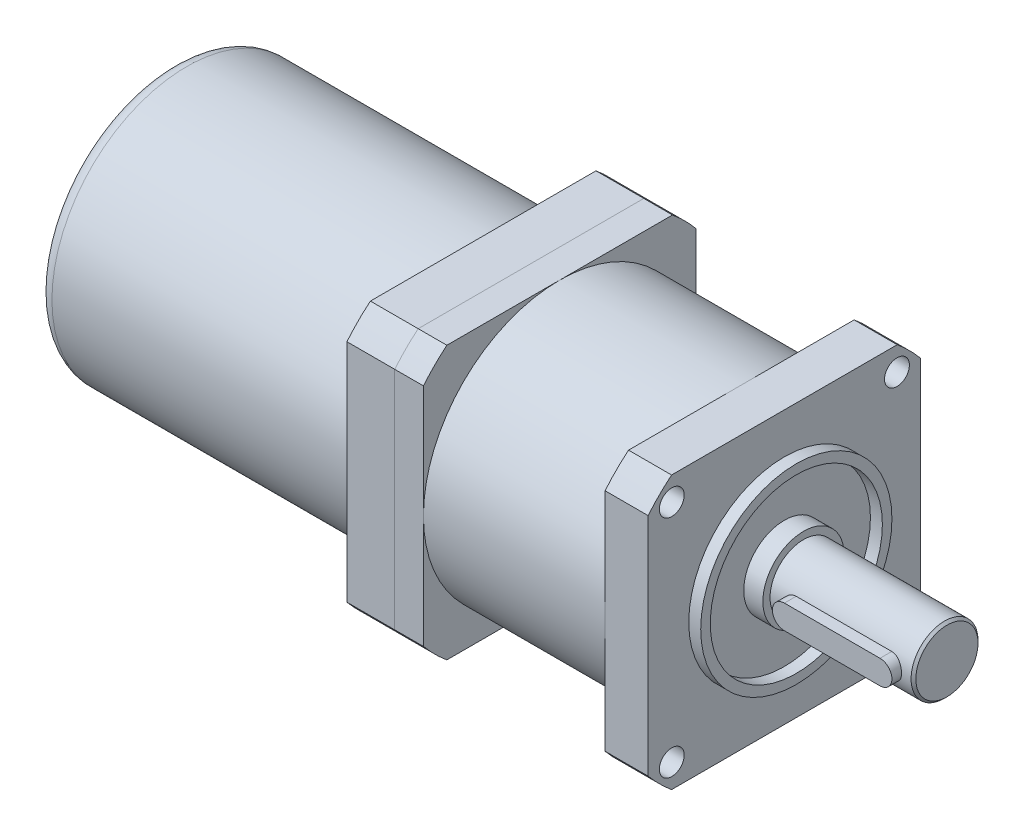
SolidWorks part; units mm, degrees
ref_plane "前视基准面" through (0, 0, 0) normal (0, 0, 1) x (1, 0, 0)
ref_plane "上视基准面" through (0, 0, 0) normal (0, 1, 0) x (1, 0, 0)
ref_plane "右视基准面" through (0, 0, 0) normal (1, 0, 0) x (0, 0, -1)
sketch "草图1" plane through (0, 0, 0) normal (1, 0, 0) x (0, 0, -1)
  line L1 (-23.5956, -28.5) -> (23.5956, -28.5)
  line L2 (-28.5, -23.5956) -> (-28.5, 23.5956)
  line L3 (-23.5956, 28.5) -> (23.5956, 28.5)
  line L4 (28.5, -23.5956) -> (28.5, 23.5956)
  line L5 (-26.163, -26.163) -> (26.163, 26.163) construction
  line L6 (-26.163, 26.163) -> (26.163, -26.163) construction
  arc A0 (-28.5, -23.5956) -> (-23.5956, -28.5) centre (0, 0) ccw
  arc A1 (-23.5956, 28.5) -> (-28.5, 23.5956) centre (0, 0) ccw
  arc A2 (28.5, 23.5956) -> (23.5956, 28.5) centre (0, 0) ccw
  arc A3 (23.5956, -28.5) -> (28.5, -23.5956) centre (0, 0) ccw
  point P0 (0, 0)
extrude "凸台-拉伸1" add sketch "草图1" against normal blind 9
sketch "草图2" plane through (-9, 0, 0) normal (-1, 0, 0) x (0, 0, 1)
  circle A0 centre (0, 0) radius 28.5
extrude "凸台-拉伸2" add sketch "草图2" along normal blind 38
sketch "草图3" plane through (-47, 0, 0) normal (-1, 0, 0) x (0, 0, 1)
  line L1 (-23.5956, -28.5) -> (23.5956, -28.5)
  line L2 (-28.5, -23.5956) -> (-28.5, 23.5956)
  line L3 (-23.5956, 28.5) -> (23.5956, 28.5)
  line L4 (28.5, -23.5956) -> (28.5, 23.5956)
  line L5 (-26.163, -26.163) -> (26.163, 26.163) construction
  line L6 (-26.163, 26.163) -> (26.163, -26.163) construction
  arc A0 (-28.5, -23.5956) -> (-23.5956, -28.5) centre (0, 0) ccw
  arc A1 (23.5956, -28.5) -> (28.5, -23.5956) centre (0, 0) ccw
  arc A2 (28.5, 23.5956) -> (23.5956, 28.5) centre (0, 0) ccw
  arc A3 (-23.5956, 28.5) -> (-28.5, 23.5956) centre (0, 0) ccw
  point P0 (0, 0)
extrude "凸台-拉伸3" add sketch "草图3" along normal blind 6
sketch "草图6" plane through (0, 0, 0) normal (1, 0, 0) x (0, 0, -1)
  circle A0 centre (-23.55, 23.55) radius 2.6
  circle A1 centre (23.55, 23.55) radius 2.6
  circle A2 centre (23.55, -23.55) radius 2.6
  circle A3 centre (-23.55, -23.55) radius 2.6
  point P0 (0, 0)
extrude "切除-拉伸2" cut sketch "草图6" against normal blind 9
sketch "草图7" plane through (0, 0, 0) normal (1, 0, 0) x (0, 0, -1)
  circle A0 centre (0, 0) radius 20
  circle A1 centre (0, 0) radius 18
extrude "凸台-拉伸5" add sketch "草图7" along normal blind 2.5
sketch "草图8" plane through (0, 0, 0) normal (1, 0, 0) x (0, 0, -1)
  circle A0 centre (0, 0) radius 8.5
extrude "凸台-拉伸6" add sketch "草图8" along normal blind 4
sketch "草图9" plane through (4, 0, 0) normal (1, 0, 0) x (0, 0, -1)
  circle A0 centre (0, 0) radius 7
extrude "凸台-拉伸7" add sketch "草图9" along normal blind 30
ref_plane "基准面1" through (0, 0, 7) normal (0, 0, 1) x (1, 0, 0)
sketch "草图10" plane through (0, 0, 7) normal (0, 0, 1) x (1, 0, 0)
  line L3 (9, 2.5) -> (29, 2.5)
  line L5 (29, -2.5) -> (9, -2.5)
  arc A0 (29, -2.5) -> (29, 2.5) centre (29, 0) ccw
  arc A1 (9, 2.5) -> (9, -2.5) centre (9, 0) ccw
extrude "切除-拉伸3" cut sketch "草图10" against normal blind 3
sketch "草图11" plane through (0, 0, 4) normal (0, 0, 1) x (1, 0, 0)
  line L0 (9, 2.5) -> (29, 2.5)
  line L2 (29, -2.5) -> (9, -2.5)
  arc A0 (9, 2.5) -> (9, -2.5) centre (9, 0) ccw
  arc A1 (29, -2.5) -> (29, 2.5) centre (29, 0) ccw
extrude "凸台-拉伸8" add sketch "草图11" along normal blind 5
chamfer "倒角1" distance 0.5 angle 45 1 edges at (34, 0, -7)
sketch "草图14" plane through (-53, 0, 0) normal (-1, 0, 0) x (0, 0, 1)
  line L1 (-23.5956, -28.5) -> (23.5956, -28.5)
  line L2 (-28.5, -23.5956) -> (-28.5, 23.5956)
  line L3 (-23.5956, 28.5) -> (23.5956, 28.5)
  line L4 (28.5, -23.5956) -> (28.5, 23.5956)
  line L5 (-26.163, -26.163) -> (26.163, 26.163) construction
  line L6 (-26.163, 26.163) -> (26.163, -26.163) construction
  arc A0 (-23.5956, 28.5) -> (-28.5, 23.5956) centre (0, 0) ccw
  arc A1 (-28.5, -23.5956) -> (-23.5956, -28.5) centre (0, 0) ccw
  arc A2 (23.5956, -28.5) -> (28.5, -23.5956) centre (0, 0) ccw
  arc A3 (28.5, 23.5956) -> (23.5956, 28.5) centre (0, 0) ccw
  point P0 (0, 0)
extrude "凸台-拉伸9" add sketch "草图14" along normal blind 10 separate body
sketch "草图15" plane through (-63, 0, 0) normal (-1, 0, 0) x (0, 0, 1)
  circle A0 centre (0, 0) radius 28.2
extrude "凸台-拉伸10" add sketch "草图15" along normal blind 65
fillet "圆角1" radius 3 1 edges at (-128, 0, 28.2)
